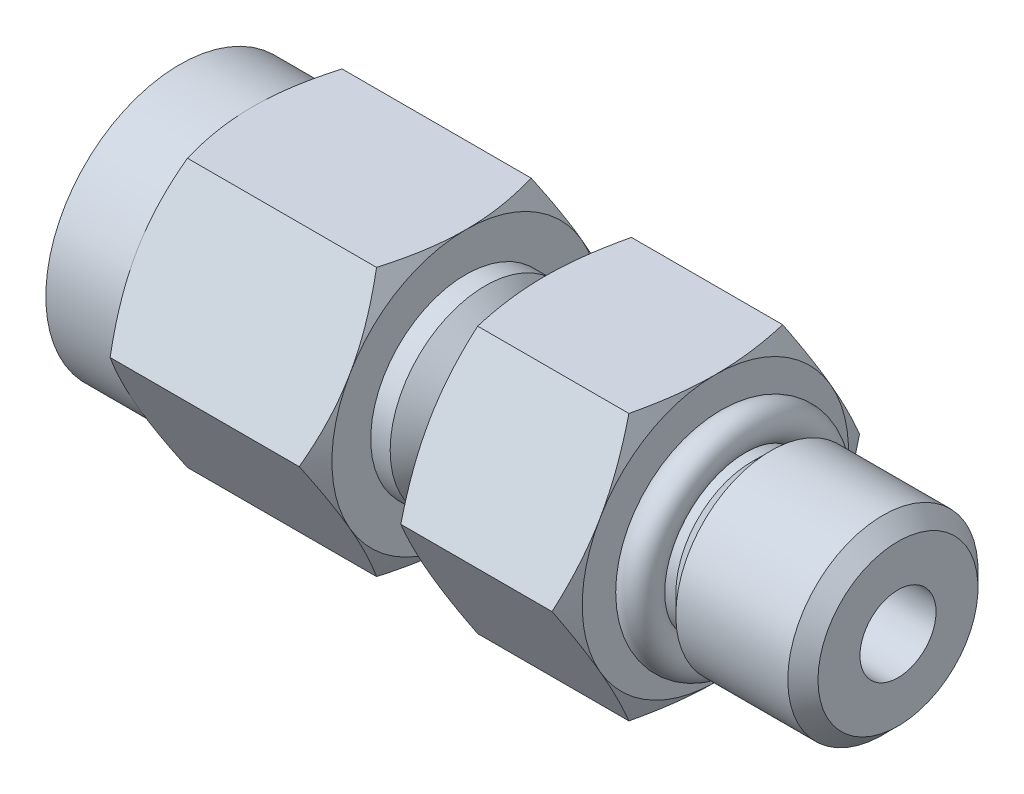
SolidWorks part; units mm, degrees
ref_plane "Front Plane" through (0, 0, 0) normal (0, 0, 1) x (1, 0, 0)
ref_plane "Top Plane" through (0, 0, 0) normal (0, 1, 0) x (1, 0, 0)
ref_plane "Right Plane" through (0, 0, 0) normal (1, 0, 0) x (0, 0, -1)
imported_body "Imported1"
sketch "Sketch1" plane through (0, 0, 0) normal (1, 0, 0) x (0, 0, -1)
  circle A0 centre (0, 0) radius 1.5875
  dimension "D1" = 3.175
extrude "Cut-Extrude1" cut sketch "Sketch1" against normal through all
